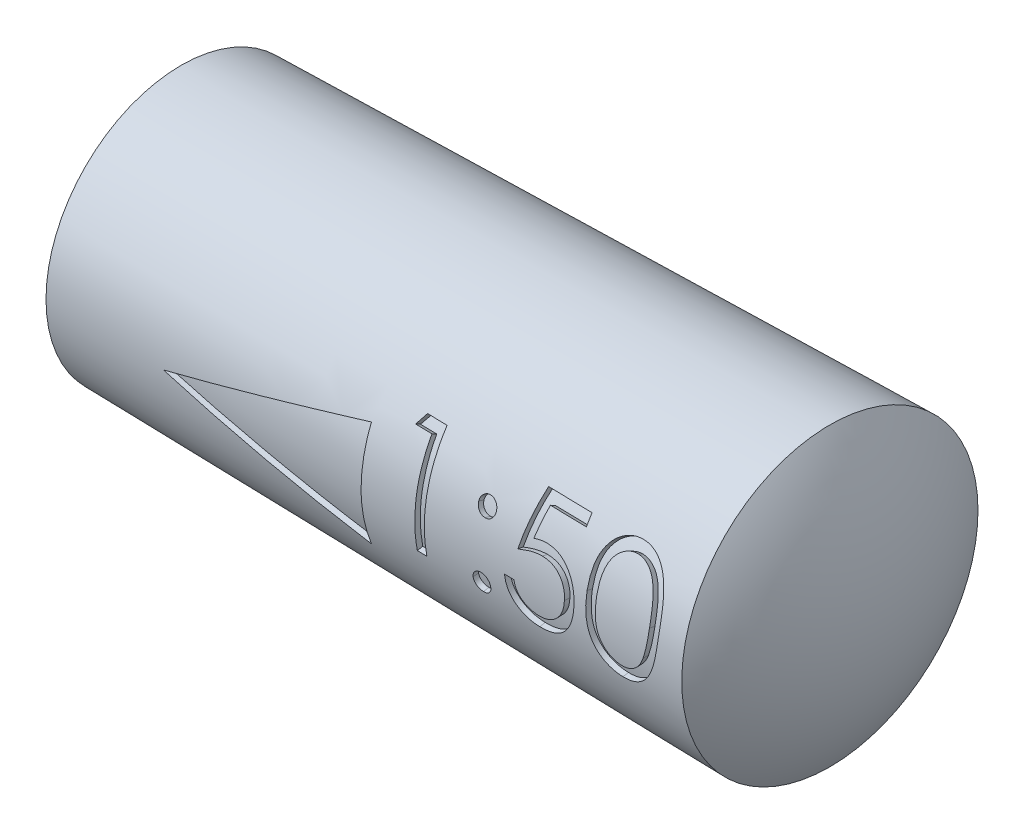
SolidWorks part; units mm, degrees
ref_plane "Front Plane" through (0, 0, 0) normal (0, 0, 1) x (1, 0, 0)
ref_plane "Top Plane" through (0, 0, 0) normal (0, 1, 0) x (1, 0, 0)
ref_plane "Right Plane" through (0, 0, 0) normal (1, 0, 0) x (0, 0, -1)
sketch "Sketch1" plane through (0, 0, 0) normal (1, 0, 0) x (0, 0, -1)
  circle A0 centre (0, 0) radius 1.25
  dimension "D1" = 2.5
extrude "Extrude1" add sketch "Sketch1" along normal mid plane 6
draft "Draft1" type of draft neutral plane draft angle 1.146 faces to draft 1 parameters "D1"=1.146
sketch "Sketch2" plane through (0, 0, 0) normal (0, 0, 1) x (1, 0, 0)
  line L0 (-3, 0) -> (-3, 1.25)
  line L1 (-3, 1.25) -> (-3, -1.25) construction
  line L2 (-3, 0) -> (-3.4, 0)
  line L3 (-3.4, 0) -> (-3.4, -1.31) construction
  line L4 (3, 0) -> (3, 1.37)
  line L5 (3, -1.37) -> (3, 1.37) construction
  line L6 (3, 0) -> (3.4, 0)
  line L7 (3.4, 0) -> (3.4, -1.31) construction
  line L8 (-3, -1.25) -> (3, -1.37) construction
  arc A0 (-3.4, 0) -> (-3, 1.25) centre (-1.2469, 0) cw
  arc A1 (3.4, 0) -> (3, 1.37) centre (0.8539, 0) ccw
  point P14 (0, -1.31)
revolve "Revolve1" add sketch "Sketch2" angle 360 about L2
sketch "Sketch5" plane through (0, 0, 0) normal (0, 0, 1) x (1, 0, 0)
  line L0 (0, 1.31) -> (0, -1.31) construction
  line L1 (3, 1.37) -> (-3, 1.25) construction
  line L2 (-3, -1.25) -> (3, -1.37) construction
ref_plane "Plane2" through (0, 0, 0) normal (-0.02, 0, 0.9998) x (0.9998, 0, 0.02)
sketch "Sketch6" plane through (0, 0, 0) normal (-0.02, 0, 0.9998) x (0.9998, 0, 0.02)
  line L0 (0, 0) -> (0, 0.5)
  line L1 (0, 1.31) -> (0, -1.31) construction
  line L2 (0, 0.5) -> (-1.866, 0)
  line L3 (-1.866, 0) -> (0, -0.5)
  line L4 (0, -0.5) -> (0, 0)
  line L5 (0, -0.25) -> (3, -0.25) construction
  text T0 "1:50" font "Century Gothic" height 1
  dimension "D1" = 1
  dimension "D2" = 30
  dimension "D3" = 3
wrap "Wrap2" sketch "Sketch6" wrap type deboss source sketch "Sketch6" thickness 0.05 parameters "D1"=0.05
equation "\"D2@Sketch2\" = \"D1@Sketch2\""
